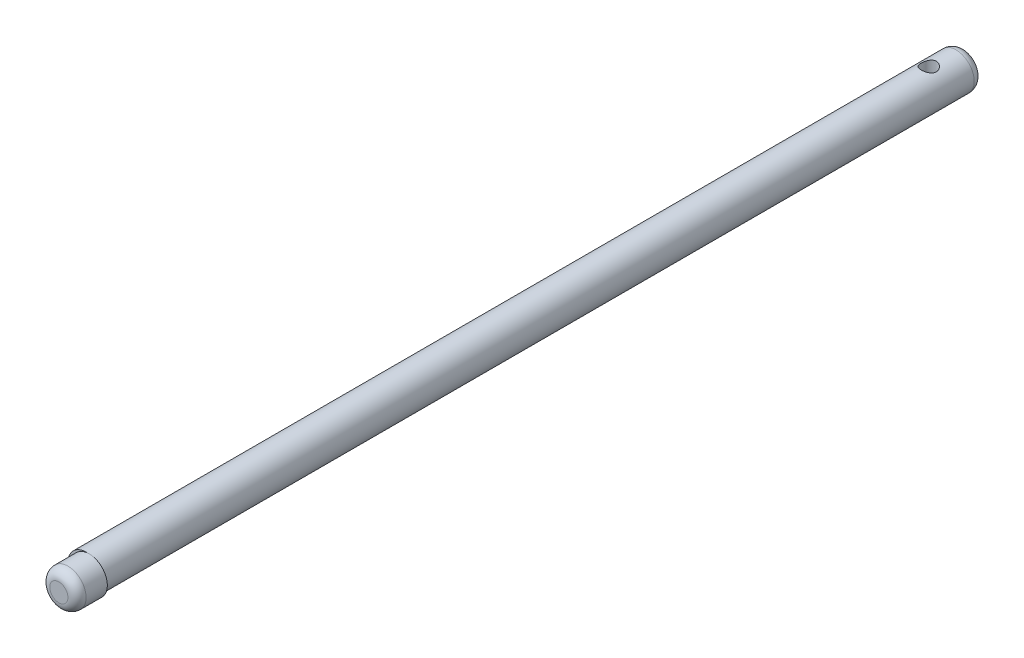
SolidWorks part; units mm, degrees
ref_plane "Front" through (0, 0, 0) normal (0, 0, 1) x (1, 0, 0)
ref_plane "Top" through (0, 0, 0) normal (0, 1, 0) x (1, 0, 0)
ref_plane "Right" through (0, 0, 0) normal (1, 0, 0) x (0, 0, -1)
sketch "Esquisse1" plane through (0, 0, 0) normal (0, 0, 1) x (1, 0, 0)
  circle A0 centre (0, 0) radius 3
  dimension "D1" = 6
extrude "Boss.-Extru.1" add sketch "Esquisse1" along normal blind 145
sketch "Esquisse2" plane through (0, 0, 0) normal (0, 1, 0) x (1, 0, 0)
  line L0 (0, 0) -> (0, -6) construction
  circle A0 centre (0, -6) radius 1.25
  dimension "D2" = 2.5
  dimension "D1" = 6
extrude "Enlèv. mat.-Extru.1" cut sketch "Esquisse2" against normal through all and the other way through all
sketch "Esquisse3" plane through (0, 0, 145) normal (0, 0, 1) x (1, 0, 0)
  line L0 (0, 0) -> (0.5, 0) construction
  circle A0 centre (0.5, 0) radius 3
  dimension "D2" = 6
  dimension "D1" = 0.5
extrude "Boss.-Extru.2" add sketch "Esquisse3" along normal blind 5
fillet "Congé1" radius 1.5 2 edges at (3, 0, 0) (3.5, 0, 150)
sketch "Esquisse5" plane through (0, 0, 150) normal (0, 0, 1) x (1, 0, 0)
  point P0 (0, 0)
